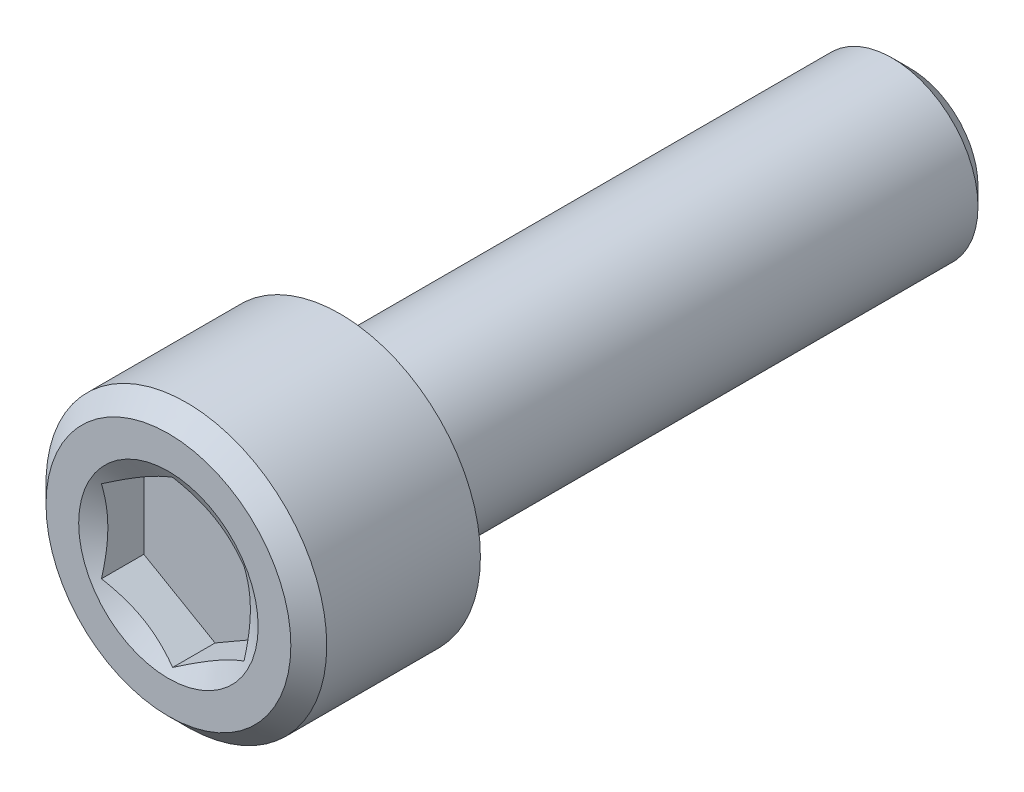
SolidWorks part; units mm, degrees
ref_plane "Top" through (0, 0, 0) normal (0, 0, 1) x (1, 0, 0)
ref_plane "Front" through (0, 0, 0) normal (0, 1, 0) x (1, 0, 0)
ref_plane "Right" through (0, 0, 0) normal (1, 0, 0) x (0, 0, -1)
sketch "Ske1" plane through (0, 0, 0) normal (0, 0, 1) x (1, 0, 0)
  circle A0 centre (0, 0) radius 3.91
  dimension "Head_Dia" = 7.82
extrude "Base1" add sketch "Ske1" along normal blind 4.78
sketch "BodySke" plane through (0, 0, 0) normal (1, 0, 0) x (0, 0, -1)
  line L0 (-1.3858, 0) -> (15.88, 0) construction
  line L1 (0, -3.91) -> (0, 3.91) construction
  line L3 (-4.78, 0) -> (0, 0) construction
  line L4 (15.88, 2.39) -> (-4.78, 2.39)
  line L7 (-4.78, 3.91) -> (-4.78, -3.91) construction
  line L8 (-4.78, 2.39) -> (-4.78, 0)
  line L9 (-4.78, 0) -> (15.88, 0)
  line L10 (15.88, 0) -> (15.88, 2.39)
  line L11 (-4.78, 0) -> (9.169, 0) construction
  line L12 (0.5, 0) -> (0.5, 5.6548) construction
  line L13 (7.88, 0) -> (7.88, 5.6548) construction
  dimension "Diameter" = 4.78
  dimension "Advance" = 0.5
  dimension "Thread_nom" = 8
  dimension "Length" = 15.88
revolve "BaseBody" add sketch "BodySke" angle 360 about L0
sketch "Ske8" plane through (0, 0, 4.78) normal (0, 0, 1) x (1, 0, 0)
  line L1 (0, 2.2921) -> (-1.985, 1.146)
  line L2 (-1.985, 1.146) -> (-1.985, -1.146)
  line L3 (-1.985, -1.146) -> (0, -2.2921)
  line L4 (0, -2.2921) -> (1.985, -1.146)
  line L5 (1.985, -1.146) -> (1.985, 1.146)
  line L6 (1.985, 1.146) -> (0, 2.2921)
  circle A0 centre (0, 0) radius 1.985 construction
  dimension "Width_Flats" = 3.97
extrude "Hex" cut sketch "Ske8" against normal blind 1.3
sketch "Ske9" plane through (0, 0, 4.78) normal (0, 0, 1) x (1, 0, 0)
  circle A1 centre (0, 0) radius 2.5
  dimension "Head_Fillet" = 5
extrude "Chamfer" cut sketch "Ske9" against normal blind 1.3 draft 60
chamfer "Chamfer1" distance 0.5 angle 45 2 edges at (2.39, 0, -15.88) (3.91, 0, 4.78)
equation "\"Thread_length@ThreadCosmetic\" = ((sgn( (\"Length@BodySke\" - \"Advance@BodySke\" * 2.0 ) - \"Thread_nom@BodySke\" )-1)*( (\"Length@BodySke\" - \"Advance@BodySke\"  * 2.0) - \"Thread_nom@BodySke\" ))/-2+ \"Thread_"
